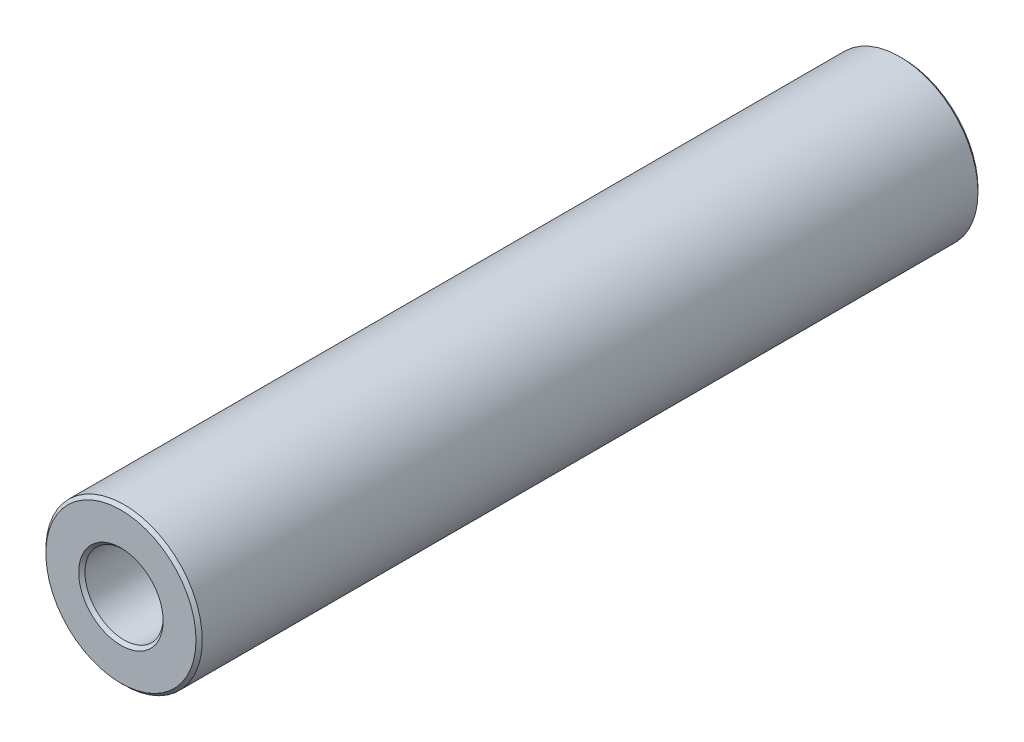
SolidWorks part; units mm, degrees
ref_plane "Front Plane" through (0, 0, 0) normal (0, 0, 1) x (1, 0, 0)
ref_plane "Top Plane" through (0, 0, 0) normal (0, 1, 0) x (1, 0, 0)
ref_plane "Right Plane" through (0, 0, 0) normal (1, 0, 0) x (0, 0, -1)
sketch "Sketch1" plane through (0, 0, 0) normal (0, 0, 1) x (1, 0, 0)
  circle A0 centre (0, 0) radius 2.5
  circle A1 centre (0, 0) radius 1.25
  dimension "D1" = 5
  dimension "D2" = 2.5
extrude "Boss-Extrude2" add sketch "Sketch1" along normal mid plane 25
chamfer "Chamfer3" distance 0.1 angle 45 4 edges at (2.5, 0, 12.5) (2.5, 0, -12.5) (1.25, 0, -12.5) (1.25, 0, 12.5)
